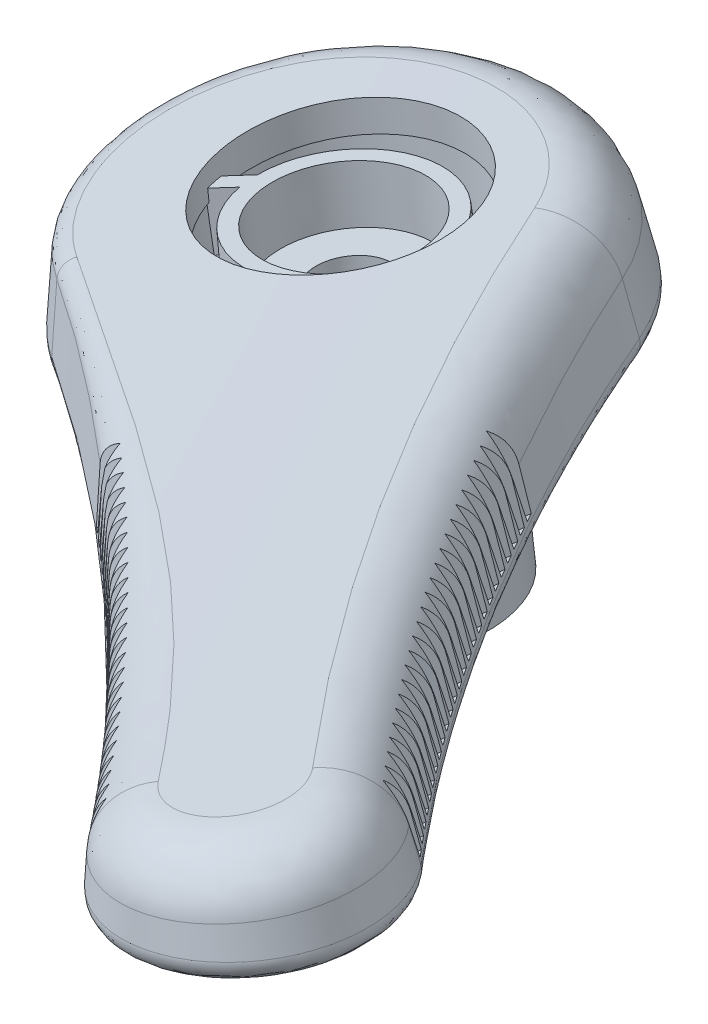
SolidWorks part; units mm, degrees
ref_plane "Front" through (0, 0, 0) normal (0, 0, 1) x (1, 0, 0)
ref_plane "Top" through (0, 0, 0) normal (0, 1, 0) x (1, 0, 0)
ref_plane "Right" through (0, 0, 0) normal (1, 0, 0) x (0, 0, -1)
imported_body "Surface-Imported386"
sketch "Sketch1" plane through (32.5799, -300.9277, -8.8774) normal (0.1076, -0.9938, -0.0293) x (0.9942, 0.1075, 0.0032)
  line L0 (1661.4419, 602.8642) -> (1664.0038, 605.936) construction
  line L1 (1672.0299, 615.5835) -> (1674.5919, 618.6553) construction
  line L2 (1680.4404, 625.6869) -> (1683.0024, 628.7587) construction
  line L3 (1688.104, 634.8931) -> (1690.666, 637.9649) construction
  circle A0 centre (1662.7228, 604.4001) radius 2
  circle A1 centre (1673.3109, 617.1194) radius 2
  circle A2 centre (1681.7214, 627.2228) radius 2
  circle A3 centre (1689.385, 636.429) radius 2
surface "Surface-Extrude1" sketch "Sketch1"
surface "Surface-Plane1"
surface "Surface-Knit1"
